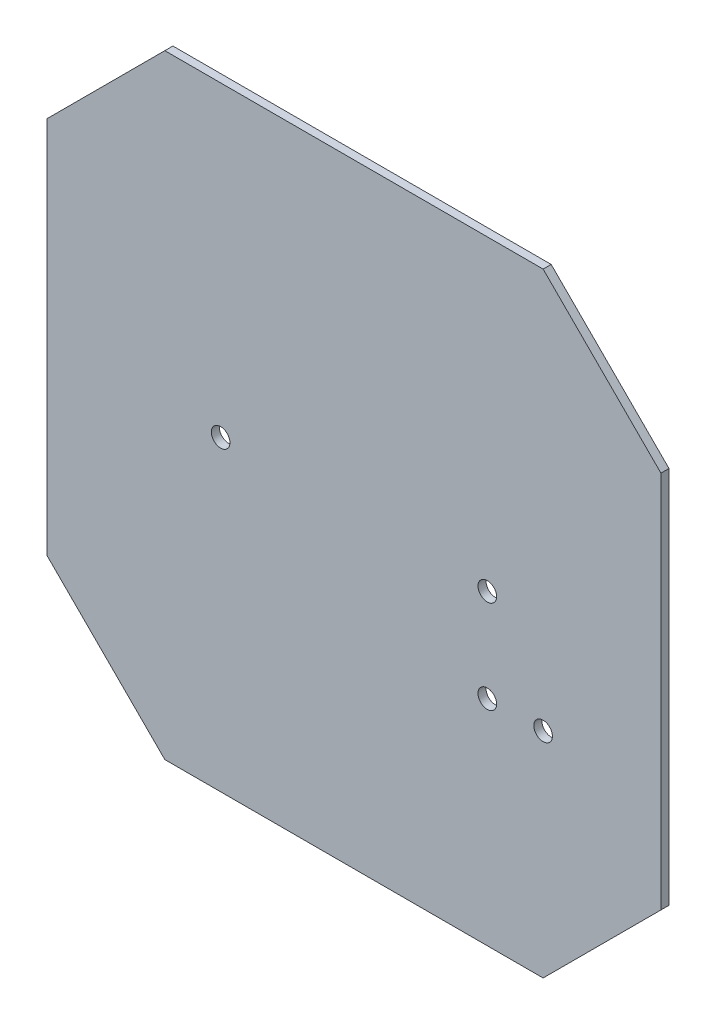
SolidWorks part; units mm, degrees
ref_plane "Front Plane" through (0, 0, 0) normal (0, 0, 1) x (1, 0, 0)
ref_plane "Top Plane" through (0, 0, 0) normal (0, 1, 0) x (1, 0, 0)
ref_plane "Right Plane" through (0, 0, 0) normal (1, 0, 0) x (0, 0, -1)
sketch "Sketch1" plane through (0, 0, 0) normal (0, 0, 1) x (1, 0, 0)
  line L0 (-29.649, 62.0347) -> (-29.649, 1.0347)
  line L1 (-10.649, 81.0347) -> (-29.649, 62.0347)
  line L2 (-29.649, 1.0347) -> (-10.649, -17.9653)
  line L3 (50.351, -17.9653) -> (69.351, 1.0347)
  line L4 (69.351, 62.0347) -> (50.351, 81.0347)
  line L5 (-10.649, -17.9653) -> (50.351, -17.9653)
  line L6 (69.351, 1.0347) -> (69.351, 62.0347)
  line L7 (50.351, 81.0347) -> (-10.649, 81.0347)
  circle A0 centre (-1.649, 31.5347) radius 1.5
  circle A1 centre (41.351, 31.5347) radius 1.5
  circle A2 centre (41.351, 16.5347) radius 1.5
  circle A3 centre (50.351, 16.5347) radius 1.5
extrude "Boss-Extrude1" add sketch "Sketch1" along normal blind 1.3
